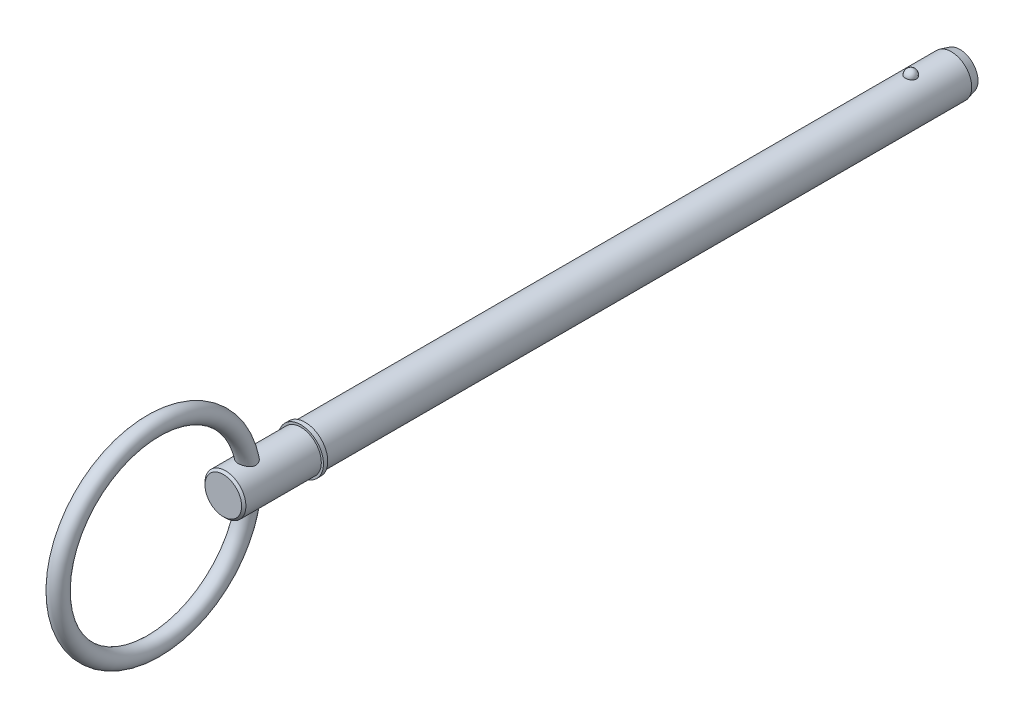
SolidWorks part; units mm, degrees
ref_plane "Front Plane" through (0, 0, 0) normal (0, 0, 1) x (1, 0, 0)
ref_plane "Top Plane" through (0, 0, 0) normal (0, 1, 0) x (1, 0, 0)
ref_plane "Right Plane" through (0, 0, 0) normal (1, 0, 0) x (0, 0, -1)
sketch "Sketch2" plane through (0, 0, 0) normal (0, 0, 1) x (1, 0, 0)
  circle A0 centre (0, 0) radius 4.765
  point P3 (0, 4.765)
  dimension "D1" = 9.53
extrude "Boss-Extrude1" add sketch "Sketch2" along normal blind 139.7
sketch "Sketch3" plane through (0, 0, 0) normal (0, 0, -1) x (-1, 0, 0)
  circle A0 centre (0, 0) radius 4.765
  dimension "D1" = 9.53
extrude "Boss-Extrude2" add sketch "Sketch3" along normal blind 12.7
chamfer "Chamfer1" distance 2 angle 15 1 edges at (-4.765, 0, -12.7)
sketch "Sketch18" plane through (0, 0, 0) normal (1, 0, 0) x (0, 0, -1)
  line L0 (10.7, 4.765) -> (-139.7, 4.765) construction
  line L1 (1.29, 6.055) -> (1.29, 3.475)
  line L2 (-139.7, -4.765) -> (10.7, -4.765) construction
  arc A0 (1.29, 6.055) -> (1.29, 3.475) centre (1.29, 4.765) ccw
  point P4 (0, 4.765)
  dimension "D1" = 10.82
revolve "Revolve1" add sketch "Sketch18" angle 360 about L1
sketch "Sketch19" plane through (0, 0, 0) normal (1, 0, 0) x (0, 0, -1)
  line L0 (-33.7288, 0) -> (-46.4542, 0) construction
sketch "Sketch20" plane through (0, 0, 0) normal (1, 0, 0) x (0, 0, -1)
  line L0 (-139.7, 0) -> (-139.7, 5.265)
  line L1 (-139.7, 4.765) -> (-139.7, -4.765) construction
  line L2 (-139.7, 5.265) -> (-140.7, 5.265)
  line L3 (-140.7, 5.265) -> (-140.7, 0)
  line L4 (-33.7288, 0) -> (-46.4542, 0) construction
  line L5 (-140.7, 0) -> (-139.7, 0)
  dimension "D1" = 5.265
  dimension "D2" = 1
revolve "Revolve2" add sketch "Sketch20" angle 360 about L0
sketch "Sketch21" plane through (0, 0, 139.7) normal (0, 0, -1) x (-1, 0, 0)
  circle A0 centre (0, 0) radius 4.765
  dimension "D1" = 9.53
extrude "Boss-Extrude3" add sketch "Sketch21" against normal blind 19.05
chamfer "Chamfer2" distance 0.5 angle 45 1 edges at (-4.765, 0, 158.75)
sketch "Sketch23" plane through (0, 0, 0) normal (1, 0, 0) x (0, 0, -1)
  line L0 (-158.75, 4.265) -> (-158.75, -4.265) construction
  circle A0 centre (-174.975, 0) radius 22.225
  point P2 (-152.75, 0)
  dimension "D1" = 44.45
  dimension "D2" = 6
sketch "Sketch24" plane through (0, 0, 0) normal (0, 1, 0) x (1, 0, 0)
  circle A0 centre (0, -152.75) radius 2
  dimension "D1" = 4
sweep "Sweep1" add profiles "Sketch24" path "Sketch23"
